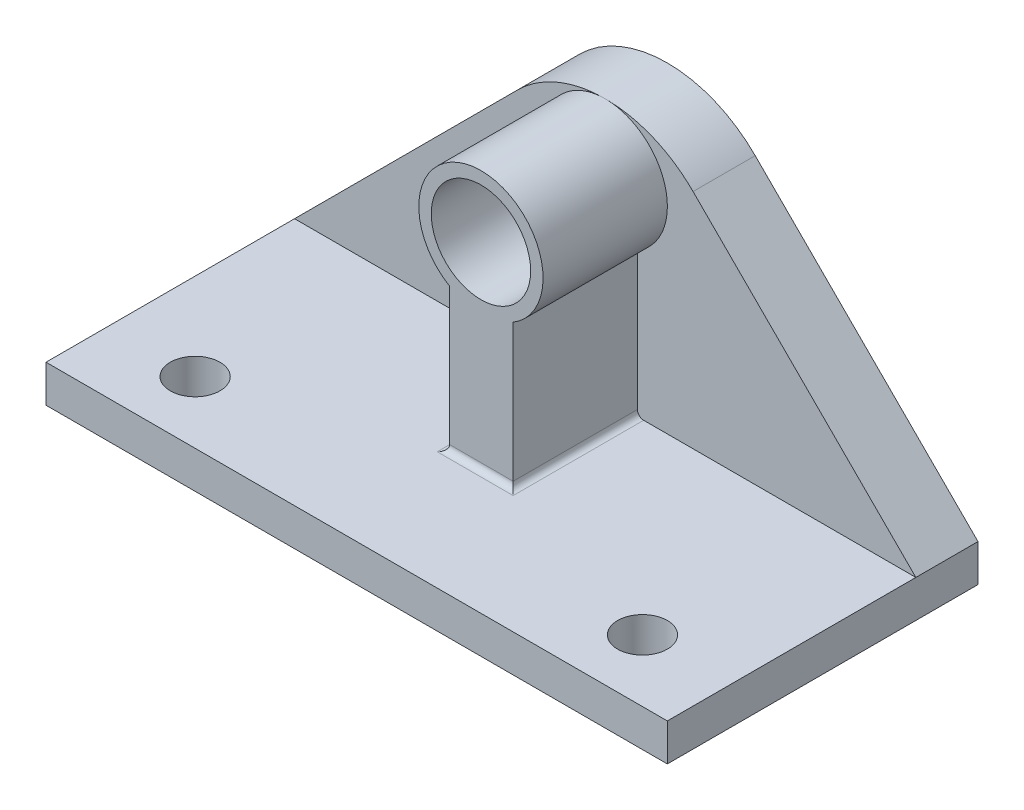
SolidWorks part; units mm, degrees
ref_plane "Ön Düzlem" through (0, 0, 0) normal (0, 0, 1) x (1, 0, 0)
ref_plane "Üst Düzlem" through (0, 0, 0) normal (0, 1, 0) x (1, 0, 0)
ref_plane "Sağ Düzlem" through (0, 0, 0) normal (1, 0, 0) x (0, 0, -1)
sketch "Çizim1" plane through (0, 0, 0) normal (0, 1, 0) x (1, 0, 0)
  line L1 (-250, 100) -> (250, 100)
  line L2 (-250, 100) -> (-250, -100)
  line L3 (-250, -100) -> (250, -100)
  line L4 (250, 100) -> (250, -100)
  line L5 (-250, 100) -> (250, -100) construction
  line L6 (-250, -100) -> (250, 100) construction
  point P0 (0, 0)
  dimension "D1" = 200
  dimension "D2" = 500
extrude "Yükseklik-Ekstrüzyon1" add sketch "Çizim1" along normal blind 30
ref_plane "Düzlem1" through (0, 0, -100) normal (0, 0, 1) x (1, 0, 0)
sketch "Çizim2" plane through (0, 0, -100) normal (0, 0, 1) x (1, 0, 0)
  line L0 (250, 30) -> (250, 0)
  line L1 (-250, 0) -> (250, 0) construction
  line L2 (250, 30) -> (70.7106, 209.2894)
  line L3 (0, -66.134) -> (0, 282.0625) construction
  line L4 (-70.8112, 209.1888) -> (-250, 30)
  line L5 (-250, 30) -> (-250, 0)
  line L6 (-250, 30) -> (250, 30) construction
  line L7 (-250, 0) -> (250, 0)
  arc A0 (70.7106, 209.2894) -> (-70.8112, 209.1888) centre (-0.0001, 138.5787) ccw
  dimension "D1" = 100
  dimension "D2" = 45
  dimension "D3" = 45
extrude "Yükseklik-Ekstrüzyon2" add sketch "Çizim2" against normal blind 50
sketch "Çizim3" plane through (0, 0, -100) normal (0, 0, 1) x (1, 0, 0)
  line L0 (-25.1437, 30) -> (-25.1437, 145.3607)
  line L1 (250, 30) -> (-250, 30) construction
  line L2 (-25.1437, 30) -> (25.9307, 30)
  line L3 (-250, 30) -> (250, 30) construction
  line L4 (25.9307, 30) -> (25.9307, 145.8282)
  arc A0 (25.9307, 145.8282) -> (-25.1437, 145.3607) centre (0, 188.5787) ccw
  arc A1 (70.7106, 209.2894) -> (-70.8112, 209.1888) centre (-0.0001, 138.5787) ccw construction
  point P2 (-0.0711, 238.5787)
  dimension "D1" = 100
  dimension "D2" = 50
extrude "Yükseklik-Ekstrüzyon3" add sketch "Çizim3" along normal blind 100
sketch "Çizim4" plane through (0, 0, 0) normal (0, 0, 1) x (1, 0, 0)
  circle A0 centre (0, 188.5787) radius 40
  dimension "D1" = 80
extrude "Kes-Ekstrüzyon2" cut sketch "Çizim4" against normal blind 210
fillet "Radyus1" radius 5 1 edges at (25.9307, 30, -50)
fillet "Radyus2" radius 5 2 edges at (-25.1437, 30, -50) (2.8935, 30, 0)
sketch "Çizim5" plane through (0, 30, 0) normal (0, 1, 0) x (1, 0, 0)
  line L0 (-250, -100) -> (250, -100) construction
  line L1 (-250, 100) -> (-250, -100) construction
  line L2 (0, 197.8212) -> (0, -170.8073) construction
  circle A0 centre (-180, -50) radius 20
  circle A1 centre (180, -50) radius 20
  dimension "D1" = 40
  dimension "D2" = 50
  dimension "D3" = 70
extrude "Kes-Ekstrüzyon3" cut sketch "Çizim5" against normal blind 210
